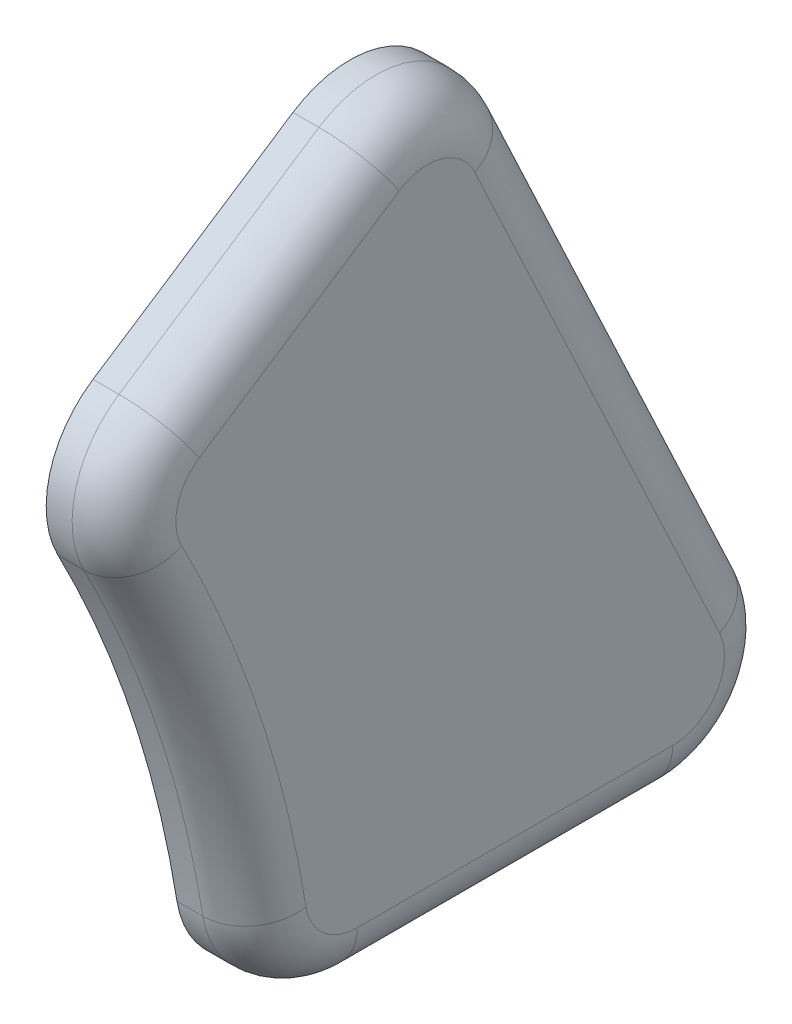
SolidWorks part; units mm, degrees
ref_plane "Alzado" through (0, 0, 0) normal (0, 0, 1) x (1, 0, 0)
ref_plane "Planta" through (0, 0, 0) normal (0, 1, 0) x (1, 0, 0)
ref_plane "Vista lateral" through (0, 0, 0) normal (1, 0, 0) x (0, 0, -1)
sketch "Croquis1" plane through (0, 0, 0) normal (1, 0, 0) x (0, 0, -1)
  line L0 (12994.1641, 4904.5983) -> (13041.3935, 4803.9869)
  line L1 (12962.4659, 4775.4882) -> (13023.289, 4775.4882)
  line L2 (12926.5321, 4887.5221) -> (12965.0874, 4912.8212)
  arc A0 (12994.1641, 4904.5983) -> (12965.0874, 4912.8212) centre (12976.0596, 4896.0996) ccw
  arc A1 (13023.289, 4775.4882) -> (13041.3935, 4803.9869) centre (13023.289, 4795.4882) ccw
  arc A2 (12942.7236, 4792.2882) -> (12919.7589, 4861.5756) centre (12715.6867, 4755.4882) ccw
  arc A3 (12942.7236, 4792.2882) -> (12962.4659, 4775.4882) centre (12962.4659, 4795.4882) ccw
  arc A4 (12926.5321, 4887.5221) -> (12919.7589, 4861.5756) centre (12937.5043, 4870.8005) ccw
extrude "Saliente-Extruir1" add sketch "Croquis1" along normal blind 15
fillet "Redondeo1" radius 10 8 edges at (15, 4854.2926, -13017.7788) (15, 4784.7638, -13040.1706) (15, 4775.4882, -12992.8775) (15, 4780.2567, -12949.5045) (15, 4827.8487, -12934.0075) (15, 4875.8521, -12918.1528) (15, 4900.1716, -12945.8097) (15, 4915.3449, -12981.5021)
